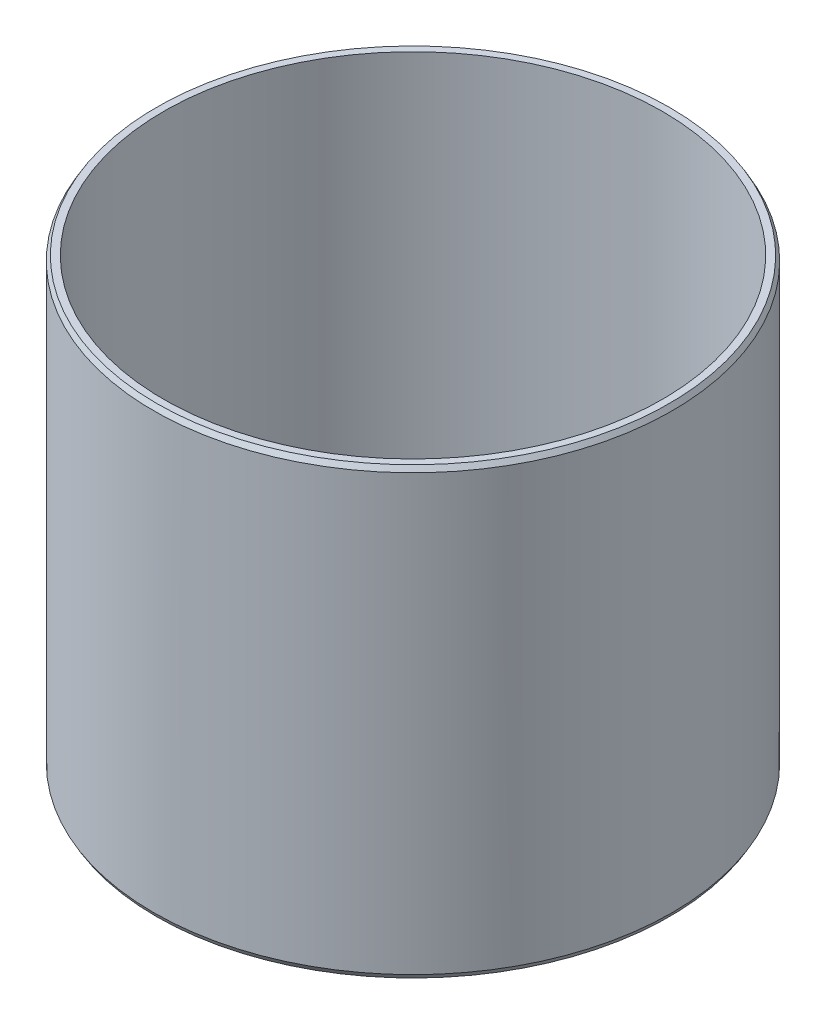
SolidWorks part; units mm, degrees
ref_plane "Plan de face" through (0, 0, 0) normal (0, 0, 1) x (1, 0, 0)
ref_plane "Plan de dessus" through (0, 0, 0) normal (0, 1, 0) x (1, 0, 0)
ref_plane "Plan de droite" through (0, 0, 0) normal (1, 0, 0) x (0, 0, -1)
sketch "Esquisse2" plane through (0, 0, 0) normal (0, 1, 0) x (1, 0, 0)
  circle A0 centre (0, 0) radius 52.5
  circle A1 centre (0, 0) radius 50.5
  dimension "D1" = 105
  dimension "D2" = 101
extrude "Extrusion1" add sketch "Esquisse2" along normal blind 90
chamfer "Chanfrein1" distance 1 angle 30 2 edges at (0, 90, 52.5) (0, 0, 52.5)
